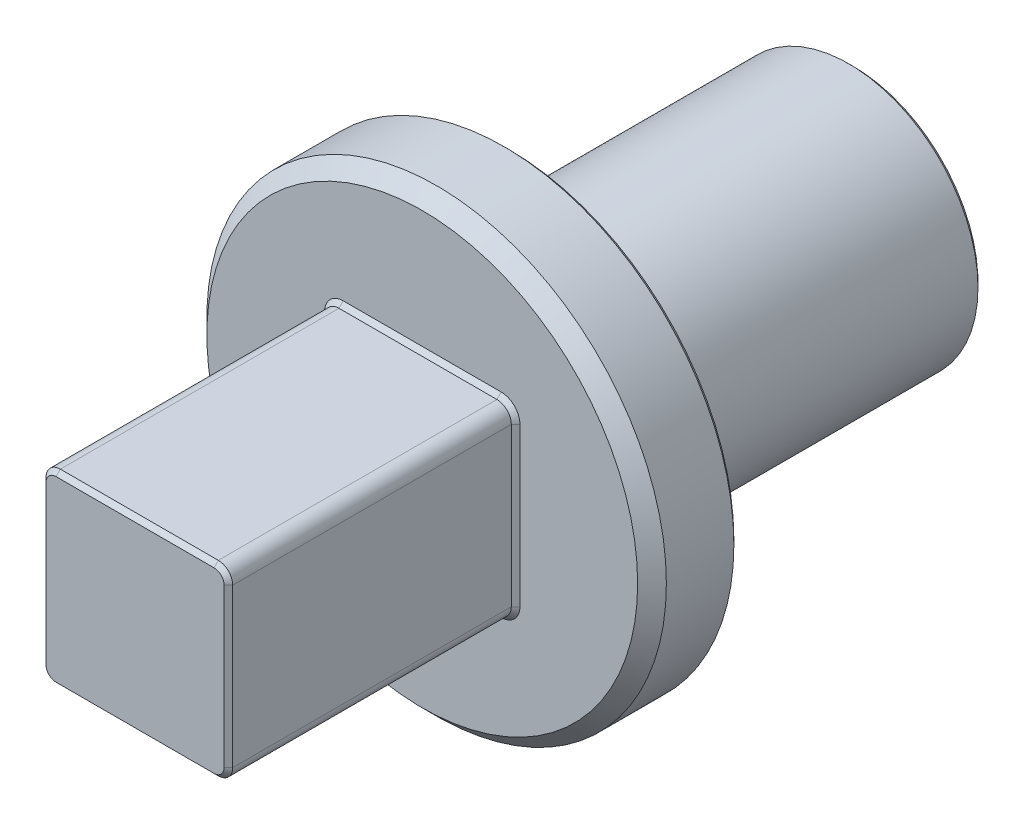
SolidWorks part; units mm, degrees
ref_plane "Спереди" through (0, 0, 0) normal (0, 0, 1) x (1, 0, 0)
ref_plane "Сверху" through (0, 0, 0) normal (0, 1, 0) x (1, 0, 0)
ref_plane "Справа" through (0, 0, 0) normal (1, 0, 0) x (0, 0, -1)
sketch "Эскиз1" plane through (0, 0, 0) normal (0, 0, 1) x (1, 0, 0)
  circle A0 centre (0, 0) radius 8
  dimension "D1" = 16
extrude "Бобышка-Вытянуть1" add sketch "Эскиз1" along normal blind 3
sketch "Эскиз2" plane through (0, 0, 3) normal (0, 0, 1) x (1, 0, 0)
  line L1 (3.25, 3.25) -> (-3.25, 3.25)
  line L2 (3.25, 3.25) -> (3.25, -3.25)
  line L3 (3.25, -3.25) -> (-3.25, -3.25)
  line L4 (-3.25, 3.25) -> (-3.25, -3.25)
  line L5 (3.25, 3.25) -> (-3.25, -3.25) construction
  line L6 (3.25, -3.25) -> (-3.25, 3.25) construction
  point P0 (0, 0)
  dimension "D1" = 6.5
extrude "Бобышка-Вытянуть2" add sketch "Эскиз2" along normal blind 10
sketch "Эскиз3" plane through (0, 0, 0) normal (0, 0, -1) x (-1, 0, 0)
  circle A0 centre (0, 0) radius 4.5
  dimension "D1" = 9
extrude "Бобышка-Вытянуть3" add sketch "Эскиз3" along normal blind 12
chamfer "Фаска1" distance 0.5 angle 45 1 edges at (8, 0, 3)
fillet "Скругление1" radius 0.5 4 edges at (-3.25, -3.25, 8) (3.25, -3.25, 8) (-3.25, 3.25, 8) (3.25, 3.25, 8)
chamfer "Фаска2" distance 0.15 angle 45 19 edges at (-3.1036, 3.1036, 13) (0, 3.25, 13) (3.1036, 3.1036, 13) (3.25, 0, 13) (3.1036, -3.1036, 13) (0, -3.25, 13) (-3.1036, -3.1036, 13) (-3.25, 0, 13) (4.5, 0, 0) (-4.5, 0, -12) (-3.25, 0, 3) (-3.1036, -3.1036, 3) (-3.1036, 3.1036, 3) (0, -3.25, 3) (0, 3.25, 3) (3.1036, -3.1036, 3) (3.1036, 3.1036, 3) (3.25, 0, 3) (8, 0, 0)
